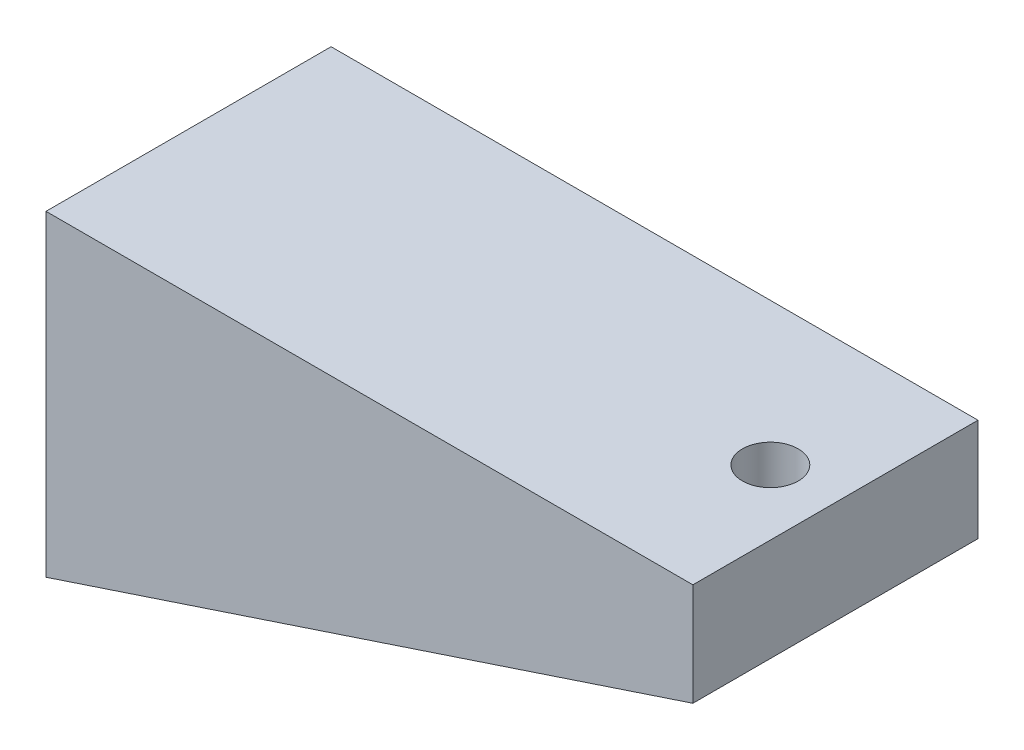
SolidWorks part; units mm, degrees
ref_plane "Front" through (0, 0, 0) normal (0, 0, 1) x (1, 0, 0)
ref_plane "Top" through (0, 0, 0) normal (0, 1, 0) x (1, 0, 0)
ref_plane "Right" through (0, 0, 0) normal (1, 0, 0) x (0, 0, -1)
sketch "Sketch1" plane through (0, 0, 0) normal (0, 0, 1) x (1, 0, 0)
  line L0 (0, 0) -> (120.2505, 39.8341)
  line L1 (120.2505, 39.8341) -> (120.2505, 58.9096)
  line L2 (120.2505, 58.9096) -> (0, 58.9096)
  line L3 (0, 58.9096) -> (0, 0)
extrude "Extrude1" add sketch "Sketch1" along normal mid plane 53
sketch "Sketch2" plane through (0, 58.9096, 0) normal (0, 1, 0) x (-1, 0, 0)
  circle A0 centre (-108.1503, 0) radius 5.1871
extrude "Cut-Extrude1" cut sketch "Sketch2" against normal offset from surface (19.5349 mm away) 5
ref_plane "Plane1" through (60, 0, 0) normal (1, 0, 0) x (0, 0, -1)
